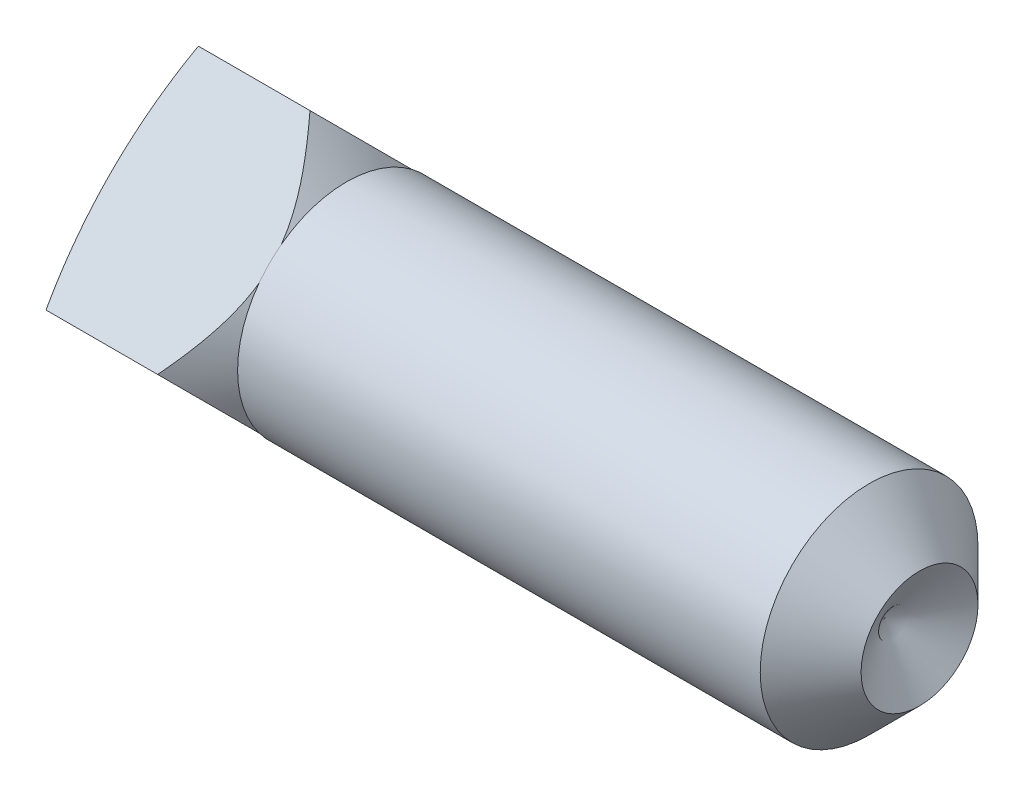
SolidWorks part; units mm, degrees
ref_plane "Plane1" through (0, 0, 0) normal (0, 0, 1) x (1, 0, 0)
ref_plane "Plane2" through (0, 0, 0) normal (0, 1, 0) x (1, 0, 0)
ref_plane "Plane3" through (0, 0, 0) normal (1, 0, 0) x (0, 0, -1)
sketch "BodySke" plane through (0, 0, 0) normal (0, 0, 1) x (1, 0, 0)
  line L0 (2.5522, -2.413) -> (11.5824, -2.413) construction
  line L1 (0, 0) -> (0, 2.413)
  line L2 (0, 2.413) -> (11.5824, 2.413)
  line L3 (12.7, -1.2954) -> (11.9216, 0) construction
  line L4 (11.9216, 0) -> (0, 0)
  line L5 (-12.7, 0) -> (88.9, 0) construction
  line L6 (11.5824, 2.413) -> (12.7, 1.2954)
  line L7 (11.5824, -2.413) -> (12.7, -1.2954) construction
  line L8 (12.7, 1.2954) -> (11.9216, 0)
  line L9 (12.7, 1.2954) -> (12.7, 7.6454) construction
  line L10 (0.7874, 6.35) -> (0.7874, -1.2954) construction
  line L11 (-7.62, 6.35) -> (-7.62, -1.2954) construction
  dimension "Length" = 12.7
  dimension "Diameter" = 4.826
  dimension "Cup_ang" = 118
  dimension "Cup_dia" = 2.5908
  dimension "Nose_ch_ang" = 45
  dimension "Advance" = 0.7874
  dimension "Thread_nom" = 20.32
revolve "BaseBody" add sketch "BodySke"
pattern_linear "ThdSchPat" [suppressed]
revolve "ThreadSchematic" cut sketch "ThdSchSke" angle 360 about L5
sketch "ThdSchSke" plane through (0, 0, 0) normal (0, 0, 1) x (1, 0, 0)
  line L0 (0.7874, -1.9406) -> (0.4566, -2.413)
  line L1 (0.7874, -1.9406) -> (1.1182, -2.413)
  line L2 (1.1182, -2.413) -> (1.1182, -3.0162)
  line L3 (-3.175, 0) -> (5.1513, 0) construction
  line L5 (1.1182, -3.0162) -> (0.4566, -3.0162)
  line L6 (0.4566, -3.0162) -> (0.4566, -2.413)
  dimension "D1" = 360
  dimension "Thread_minor" = 3.8811
  dimension "D2" = 1
  dimension "Diameter" = 4.826
  dimension "Start" = 0.7874
  dimension "D4" = 50
  dimension "SideAngle" = 55
  dimension "VeeAngle" = 70
  dimension "Overcut" = 6.0325
  dimension "Num_threads" = 15
  dimension "Advance" = 0.7711
  dimension "Thread_length" = 10.795
sketch "Sketch4" plane through (0, 0, 0) normal (-1, 0, 0) x (0, -0.7071, 0.7071)
  line L1 (-2.3876, -2.3876) -> (2.3876, -2.3876)
  line L2 (-2.3876, -2.3876) -> (-2.3876, 2.3876)
  line L3 (-2.3876, 2.3876) -> (2.3876, 2.3876)
  line L4 (2.3876, -2.3876) -> (2.3876, 2.3876)
  dimension "D1" = 4.7752
  dimension "Width_flats" = 4.7752
  dimension "D2" = 2.3876
  dimension "D3" = 2.3876
extrude "BaseHead" add sketch "Sketch4" along normal blind 3.7592
sketch "Sketch5" plane through (0, 0, 0) normal (0, 0, 1) x (1, 0, 0)
  line L0 (-3.7592, 0) -> (-16.4592, 0)
  line L1 (0, 0) -> (57.15, 0) construction
  line L2 (-12.7, 0) -> (88.9, 0) construction
  line L3 (-16.4592, 0) -> (-16.4592, 3.3766)
  line L5 (-16.4592, 3.3766) -> (-3.2823, 3.3766)
  line L6 (-3.7592, 3.3766) -> (0, 3.3766) construction
  arc A0 (-3.2823, 3.3766) -> (-3.7592, 0) centre (8.4328, 0) ccw
  dimension "Head_radius" = 12.192
  dimension "D2" = 8.4328
  dimension "D3" = 12.7
revolve "HeadCrown" cut sketch "Sketch5" angle 360 about L1
sketch "Sketch6" plane through (0, 0, 0) normal (0, 0, 1) x (1, 0, 0)
  line L0 (0, 2.413) -> (-0.8085, 3.3766)
  line L1 (0, 1.9352) -> (0, 3.3766) construction
  line L2 (0, 2.413) -> (12.7, 2.413)
  line L3 (12.7, 2.413) -> (12.7, 16.0766)
  line L5 (-0.8085, 3.3766) -> (-0.8085, 16.0766)
  line L6 (-0.8085, 16.0766) -> (12.7, 16.0766)
  line L7 (-3.2823, 3.3766) -> (0, 3.3766) construction
  line L9 (0, 0) -> (60.325, 0) construction
  dimension "D1" = 12.7
  dimension "D2" = 12.7
  dimension "D3" = 40
  dimension "D4" = 2.413
revolve "HeadChamfer1" cut sketch "Sketch6" angle 360 about L9
equation "\"D1@Sketch4\" = \"Width_flats@Sketch4\""
equation "\"D2@Sketch4\" = \"Width_flats@Sketch4\" / 2"
equation "\"D3@Sketch4\" = \"Width_flats@Sketch4\" / 2"
equation "\"D2@Sketch5\" = \"Head_radius@Sketch5\" - \"Head_ht@BaseHead\""
equation "\"Thread_length@ThreadCosmetic\" = ((sgn( (\"Length@BodySke\" - \"Advance@BodySke\" - ( ( ( \"Diameter@BodySke\" - \"Cup_dia@BodySke\" ) * 0.5 ) * tan( \"Nose_ch_ang@BodySke\" * 0.017453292 ) ) ) - \"Thread_nom@Bo"
equation "\"Thread_minor@ThdSchSke\" = \"Thread_minor@ThreadCosmetic\""
equation "\"Diameter@ThdSchSke\" = \"Diameter@BodySke\""
equation "\"Overcut@ThdSchSke\" = \"Diameter@BodySke\" * 1.25"
equation "\"Start@ThdSchSke\" = (\"Length@BodySke\" - ( ( ( \"Diameter@BodySke\" - \"Cup_dia@BodySke\" ) * 0.5 ) * tan( \"Nose_ch_ang@BodySke\" * 0.017453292 ) ) ) - \"Thread_length@ThreadCosmetic\"  '---Non-countersunk---"
equation "\"Num_threads@ThdSchPat\" = int( \"Thread_length@ThreadCosmetic\" / \"Advance@BodySke\" + 0.999 )  + 1"
equation "\"Advance@ThdSchPat\" = \"Thread_length@ThreadCosmetic\" /  (\"Num_threads@ThdSchPat\" - 1) 'relax it"
equation "' \"Num_threads@ThdSchPat\" = \"Num_threads@ThdSchPat\" - sgn( \"Num_threads@ThdSchPat\" - 1) '---chamfered tips only---"
equation "\"D4@Sketch6\" = \"Diameter@BodySke\" / 2.0"
